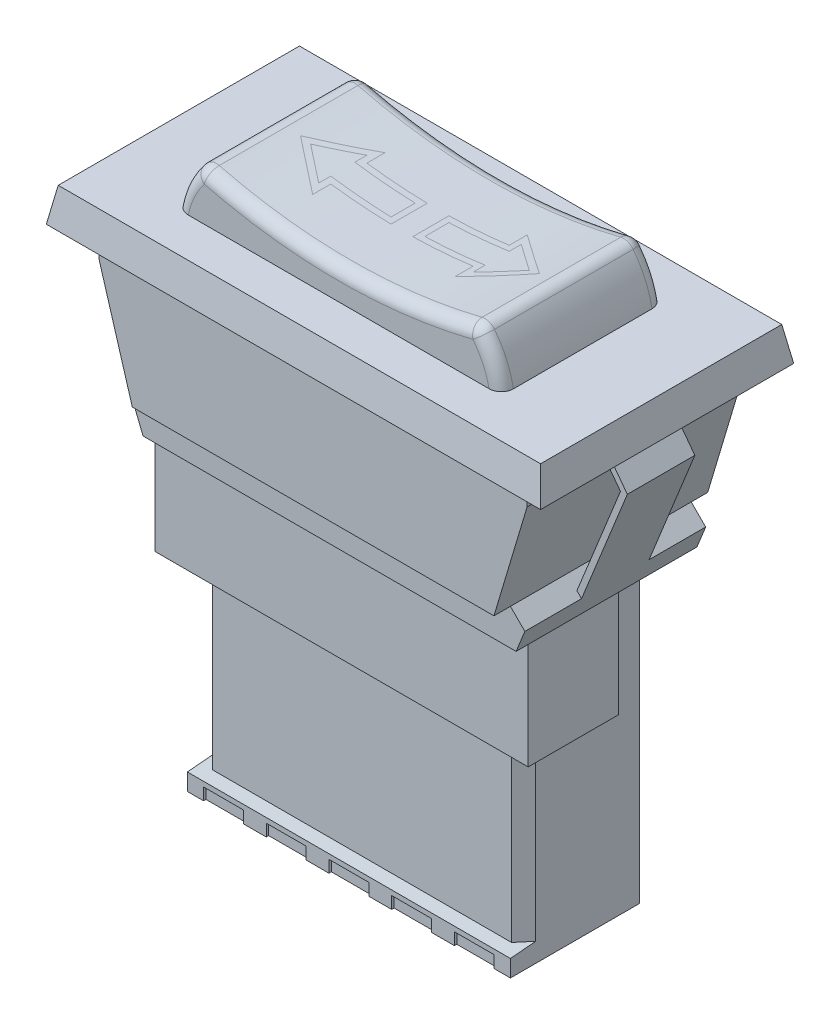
SolidWorks part; units mm, degrees
ref_plane "Plan de face" through (0, 0, 0) normal (0, 0, 1) x (1, 0, 0)
ref_plane "Plan de dessus" through (0, 0, 0) normal (0, 1, 0) x (1, 0, 0)
ref_plane "Plan de droite" through (0, 0, 0) normal (1, 0, 0) x (0, 0, -1)
sketch "Esquisse1" plane through (0, 0, 0) normal (0, 1, 0) x (1, 0, 0)
  line L1 (-20.5, 10.5) -> (20.5, 10.5)
  line L2 (-20.5, 10.5) -> (-20.5, -10.5)
  line L3 (-20.5, -10.5) -> (20.5, -10.5)
  line L4 (20.5, 10.5) -> (20.5, -10.5)
  line L5 (-20.5, 10.5) -> (20.5, -10.5) construction
  line L6 (-20.5, -10.5) -> (20.5, 10.5) construction
  point P0 (0, 0)
  dimension "D1" = 41
  dimension "D2" = 21
extrude "Boss.-Extru.1" add sketch "Esquisse1" along normal blind 2.8
sketch "Esquisse2" plane through (0, 0, 0) normal (0, 0, 1) x (1, 0, 0)
  line L0 (-20.5, 2.8) -> (20.5, 2.8) construction
  line L1 (0, 0) -> (0, 5.3) construction
  line L2 (-13.5, 2.8) -> (13.5, 2.8)
  arc A0 (13.5, 2.8) -> (11.9328, 6.2915) centre (5.6298, 1.3649) ccw
  arc A1 (10.9018, 6.6456) -> (-10.9018, 6.6456) centre (0, 50.1333) cw
  arc A2 (-13.5, 2.8) -> (-11.9328, 6.2915) centre (-5.6298, 1.3649) cw
  arc A3 (11.9328, 6.2915) -> (10.9018, 6.6456) centre (11.145, 5.6757) ccw
  arc A4 (-10.9018, 6.6456) -> (-11.9328, 6.2915) centre (-11.145, 5.6757) ccw
  point P14 (11.5, 6.8)
  point P17 (-11.5, 6.8)
  dimension "D1" = 27
  dimension "D4" = 1
  dimension "D6" = 8
  dimension "D2" = 4
  dimension "D3" = 23
  dimension "D5" = 2.5
extrude "Boss.-Extru.2" add sketch "Esquisse2" along normal mid plane 13.5
fillet "Congé1" radius 1 10 edges at (12.9283, 4.6408, -6.75) (11.4698, 6.6214, -6.75) (-12.9283, 4.6408, -6.75) (-11.4698, 6.6214, -6.75) (12.9283, 4.6408, 6.75) (11.4698, 6.6214, 6.75) (-12.9283, 4.6408, 6.75) (-11.4698, 6.6214, 6.75) (0, 5.3, -6.75) (0, 5.3, 6.75)
draft "Dépouille1" type of draft neutral plane draft angle 10 faces to draft 1 parameters "D1"=10
sketch "Esquisse4" plane through (0, 0, 0) normal (0, 0, 1) x (1, 0, 0)
  line L0 (-17.75, 0) -> (-17.75, -2)
  line L1 (-20.5, 0) -> (20.5, 0) construction
  line L2 (-17.75, -2) -> (-15, -11.2)
  line L3 (0, 0) -> (0, -11.2) construction
  line L4 (17.75, -2) -> (15, -11.2)
  line L5 (17.75, 0) -> (17.75, -2)
  line L6 (-17.75, 0) -> (17.75, 0)
  line L7 (-15, -11.2) -> (15, -11.2)
  dimension "D1" = 35.5
  dimension "D2" = 2
  dimension "D3" = 11.2
  dimension "D4" = 30
extrude "Boss.-Extru.3" add sketch "Esquisse4" along normal mid plane 17.73
sketch "Esquisse5" plane through (0, 0, 0) normal (0, 0, 1) x (1, 0, 0)
  line L0 (-15, -11.2) -> (-16.2, -12.4)
  line L1 (-16.2, -12.4) -> (-15.4723, -14.2)
  line L2 (0, 0) -> (0, -11.2) construction
  line L3 (-15, -11.2) -> (15, -11.2) construction
  line L4 (16.2, -12.4) -> (15.4723, -14.2)
  line L5 (15, -11.2) -> (16.2, -12.4)
  line L6 (-15, -11.2) -> (15, -11.2)
  line L7 (-15.4723, -14.2) -> (15.4723, -14.2)
  line L8 (-17.75, 0) -> (-20, -3) construction
  line L9 (-20, -3) -> (-16.2, -12.4) construction
  line L10 (-20.5, 0) -> (20.5, 0) construction
  dimension "D1" = 3
  dimension "D2" = 32.4
  dimension "D3" = 1.8
  dimension "D4" = 40
  dimension "D5" = 3
extrude "Boss.-Extru.4" add sketch "Esquisse5" along normal mid plane 15
sketch "Esquisse6" plane through (0, 0, 0) normal (0, 0, 1) x (1, 0, 0)
  line L0 (-17.75, 0) -> (-20, -3) construction
  line L1 (-20, -3) -> (-16.2, -12.4) construction
  line L2 (-17.75, 0) -> (-20, -3)
  line L3 (-20, -3) -> (-16.2, -12.4)
extrude "Extru.-Mince1" add sketch "Esquisse6" along normal mid plane 5.6 thin
mirror "Symétrie1" about plane through (0, 0, 0) normal (1, 0, 0) of "Extru.-Mince1"
sketch "Esquisse7" plane through (0, -14.2, 0) normal (0, -1, 0) x (1, 0, 0)
  line L3 (-15.4723, -1) -> (-15.4723, 6.5)
  line L4 (-15.4723, 7.5) -> (-15.4723, -7.5) construction
  line L5 (-15.4723, 6.5) -> (15.4723, 6.5)
  line L6 (15.4723, -1) -> (15.4723, 6.5)
  line L8 (-15.4723, 7.5) -> (15.4723, 7.5) construction
  line L9 (15.4723, 7.5) -> (15.4723, -7.5) construction
  dimension "D1" = 1
  dimension "D2" = 7.5
extrude "Extru.-Mince2" add sketch "Esquisse7" along normal blind 8.8 thin
sketch "Esquisse8" plane through (0, -14.2, 0) normal (0, -1, 0) x (1, 0, 0)
  line L1 (-13.4, 4.8) -> (13.4, 4.8)
  line L2 (-13.4, 4.8) -> (-13.4, -4.8)
  line L3 (-13.4, -4.8) -> (13.4, -4.8)
  line L4 (13.4, 4.8) -> (13.4, -4.8)
  line L5 (-13.4, 4.8) -> (13.4, -4.8) construction
  line L6 (-13.4, -4.8) -> (13.4, 4.8) construction
  line L7 (13.8723, 4.9) -> (-13.8723, 4.9) construction
  point P0 (0, 0)
  dimension "D1" = 26.8
  dimension "D2" = 0.1
extrude "Boss.-Extru.5" add sketch "Esquisse8" along normal blind 25.3
sketch "Esquisse10" plane through (0, 0, 0) normal (1, 0, 0) x (0, 0, -1)
  line L0 (-4.8, -39.5) -> (-5.9, -39.5)
  line L1 (-5.9, -39.5) -> (-5.9, -38.0962)
  line L2 (-5.9, -38.0962) -> (-4.8, -38)
  line L3 (-4.8, -39.5) -> (-4.8, -14.2) construction
  line L4 (-4.8, -38) -> (-4.8, -39.5)
  dimension "D1" = 1.1
  dimension "D2" = 1.5
  dimension "D3" = 95
extrude "Boss.-Extru.6" add sketch "Esquisse10" along normal up to surface and the other way up to surface
sketch "Esquisse12" plane through (0, 0, -4.8) normal (0, 0, -1) x (-1, 0, 0)
  line L4 (13.4, -14.2) -> (-13.4, -14.2) construction
  line L5 (12.4, -14.2) -> (-12.4, -14.2)
  line L8 (12.4, -15.2) -> (-12.4, -15.2)
  line L9 (-12.4, -15.2) -> (-12.4, -38.5)
  line L10 (-12.4, -38.5) -> (12.4, -38.5)
  line L11 (12.4, -38.5) -> (12.4, -15.2)
  line L13 (-12.4, -14.2) -> (-12.4, -38.5)
  line L14 (-12.4, -38.5) -> (12.4, -38.5)
  line L15 (12.4, -38.5) -> (12.4, -14.2)
  dimension "D1" = 1
extrude "Enlèv. mat.-Extru.1" cut sketch "Esquisse12" against normal blind 1 draft 6
sketch "Esquisse11" plane through (0, -39.5, 0) normal (0, -1, 0) x (1, 0, 0)
  line L0 (-13.4, 5.9) -> (-13.4, -4.8) construction
  line L1 (-12.0578, 4.55) -> (-8.7578, 4.55)
  line L2 (-12.0578, 4.55) -> (-12.0578, -3.45)
  line L3 (-12.0578, -3.45) -> (-8.7578, -3.45)
  line L4 (-8.7578, 4.55) -> (-8.7578, -3.45)
  line L5 (-6.8539, 4.55) -> (-3.5539, 4.55)
  line L6 (-13.4, 0.55) -> (-12.0578, 0.55) construction
  line L7 (13.4, -4.8) -> (13.4, 5.9) construction
  line L8 (-3.5539, 4.55) -> (-3.5539, -3.45)
  line L9 (-6.8539, 4.55) -> (-6.8539, -3.45)
  line L10 (-6.8539, -3.45) -> (-3.5539, -3.45)
  line L11 (-1.65, 4.55) -> (1.65, 4.55)
  line L12 (1.65, 4.55) -> (1.65, -3.45)
  line L13 (-1.65, 4.55) -> (-1.65, -3.45)
  line L14 (-1.65, -3.45) -> (1.65, -3.45)
  line L15 (3.5539, 4.55) -> (6.8539, 4.55)
  line L16 (6.8539, 4.55) -> (6.8539, -3.45)
  line L17 (3.5539, 4.55) -> (3.5539, -3.45)
  line L18 (3.5539, -3.45) -> (6.8539, -3.45)
  line L19 (8.7578, 4.55) -> (12.0578, 4.55)
  line L20 (12.0578, 4.55) -> (12.0578, -3.45)
  line L21 (8.7578, 4.55) -> (8.7578, -3.45)
  line L22 (8.7578, -3.45) -> (12.0578, -3.45)
extrude "Enlèv. mat.-Extru.2" cut sketch "Esquisse11" against normal up to surface (25.3 mm away)
chamfer "Chanfrein1" distance 1 angle 45 2 edges at (13.4, -26.1, 4.8) (-13.4, -26.1, 4.8)
sketch "Esquisse13" plane through (0, 0, 0) normal (0, 1, 0) x (1, 0, 0)
  line L0 (-0.9018, 1.5) -> (-5.9018, 1.5)
  line L1 (-5.9018, 1.5) -> (-5.9018, 3)
  line L2 (-5.9018, 3) -> (-9.9018, 0)
  line L3 (-9.9018, 0) -> (-5.9018, -3)
  line L4 (-5.9018, -3) -> (-5.9018, -1.5)
  line L5 (-5.9018, -1.5) -> (-0.9018, -1.5)
  line L6 (-0.9018, -1.5) -> (-0.9018, 1.5)
  line L7 (-10.9018, -5.75) -> (-10.9018, 5.75) construction
  line L8 (-6.4018, 2) -> (-9.0685, 0)
  line L9 (-9.0685, 0) -> (-6.4018, -2)
  line L10 (-6.4018, -2) -> (-6.4018, -1)
  line L11 (-6.4018, -1) -> (-1.4018, -1)
  line L12 (-1.4018, -1) -> (-1.4018, 1)
  line L13 (-1.4018, 1) -> (-6.4018, 1)
  line L14 (-6.4018, 1) -> (-6.4018, 2)
  point P16 (-0.9018, 0)
  dimension "D1" = 9
  dimension "D2" = 1
  dimension "D3" = 6
  dimension "D4" = 3
  dimension "D5" = 5
  dimension "D6" = 0.5
mirror "Symétrie2" about plane through (0, 0, 0) normal (1, 0, 0)
sketch "Esquisse14" plane through (0, 0, 5.9) normal (0, 0, 1) x (1, 0, 0)
  line L0 (-8.7578, -14.2) -> (-8.7578, -39.5) construction
  line L1 (-12.0578, -39.5) -> (-8.7578, -39.5)
  line L2 (-12.0578, -39.5) -> (-12.0578, -38.5)
  line L3 (-12.0578, -38.5) -> (-8.7578, -38.5)
  line L4 (-8.7578, -39.5) -> (-8.7578, -38.5)
  line L5 (12.4, -38.5) -> (-12.4, -38.5) construction
  line L6 (-3.5539, -14.2) -> (-3.5539, -39.5) construction
  line L7 (-6.8539, -39.5) -> (-3.5539, -39.5)
  line L8 (-6.8539, -39.5) -> (-6.8539, -38.5)
  line L9 (-6.8539, -38.5) -> (-3.5539, -38.5)
  line L10 (-3.5539, -39.5) -> (-3.5539, -38.5)
  line L11 (1.65, -14.2) -> (1.65, -39.5) construction
  line L12 (-1.65, -39.5) -> (1.65, -39.5)
  line L13 (-1.65, -39.5) -> (-1.65, -38.5)
  line L14 (-1.65, -38.5) -> (1.65, -38.5)
  line L15 (1.65, -39.5) -> (1.65, -38.5)
  line L16 (6.8539, -14.2) -> (6.8539, -39.5) construction
  line L17 (3.5539, -39.5) -> (6.8539, -39.5)
  line L18 (3.5539, -39.5) -> (3.5539, -38.5)
  line L19 (3.5539, -38.5) -> (6.8539, -38.5)
  line L20 (6.8539, -39.5) -> (6.8539, -38.5)
  line L21 (12.0578, -14.2) -> (12.0578, -39.5) construction
  line L22 (8.7578, -39.5) -> (12.0578, -39.5)
  line L23 (8.7578, -39.5) -> (8.7578, -38.5)
  line L24 (8.7578, -38.5) -> (12.0578, -38.5)
  line L25 (12.0578, -39.5) -> (12.0578, -38.5)
extrude "Enlèv. mat.-Extru.3" cut sketch "Esquisse14" against normal blind 0.2
equation "\"D5@Esquisse11\"=\"D4@Esquisse11\""
